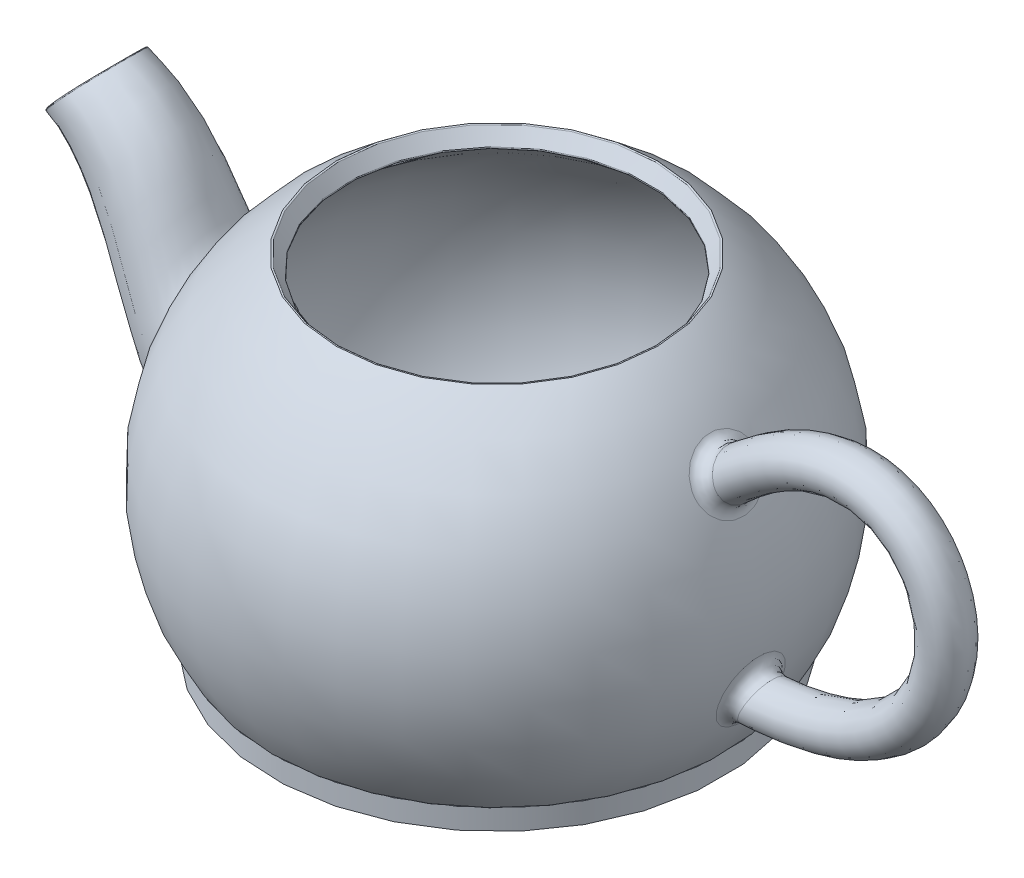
SolidWorks part; units mm, degrees
ref_plane "Спереди" through (0, 0, 0) normal (0, 0, 1) x (1, 0, 0)
ref_plane "Сверху" through (0, 0, 0) normal (0, 1, 0) x (1, 0, 0)
ref_plane "Справа" through (0, 0, 0) normal (1, 0, 0) x (0, 0, -1)
sketch "Эскиз1" plane through (0, 0, 0) normal (0, 0, 1) x (1, 0, 0)
  line L0 (0, 0) -> (350, 0)
  line L1 (0, 0) -> (0, 500)
  line L2 (0, 500) -> (250, 500)
  arc A0 (350, 0) -> (250, 500) centre (50.7704, 200.1541) ccw
  dimension "D3" = 360
  dimension "D1" = 250
  dimension "D2" = 500
  dimension "D4" = 350
revolve "Повернуть1" add sketch "Эскиз1" angle 360 about L1
sketch "Эскиз3" plane through (0, 0, 0) normal (0, 0, 1) x (1, 0, 0)
  line L0 (-694.1726, 404.6063) -> (-617.2746, 468.5336)
  arc A0 (-250, 500) -> (-350, 0) centre (-50.7704, 200.1541) ccw construction
  spline S0 degree 3 poles (-694.1726, 404.6063) (-543.7993, 331.9131) (-550.7728, 35.5272) (-372.0405, 37.7178) knots 0 0 0 0 1 1 1 1
  spline S1 degree 3 poles (-617.2746, 468.5336) (-474.6525, 419.6861) (-493.8046, 256.1572) (-403.7795, 270.7559) knots 0 0 0 0 1 1 1 1
  dimension "D2" = 372.0405
  dimension "D1" = 100
  dimension "D3" = 617.2746
  dimension "D4" = 694.1726
  dimension "D5" = 404.6063
ref_plane "Плоскость3" through (-360.2215, -49.0609, 0) normal (-0.9909, -0.135, 0) x (0, 0, 1)
sketch "Эскиз6" plane through (-360.2215, -49.0609, 0) normal (-0.9909, -0.135, 0) x (0, 0, 1)
  ellipse E0 centre (0, 205.1746) end of major axis (0, 322.7694) minor radius 88.5807
  dimension "D1" = 177.1615
ref_plane "Плоскость5" through (-482.5868, 580.503, 0) normal (-0.6393, 0.769, 0) x (0.769, 0.6393, 0)
sketch "Эскиз8" plane through (-482.5868, 580.503, 0) normal (-0.6393, 0.769, 0) x (0.769, 0.6393, 0)
  ellipse E0 centre (-225.1512, 0) end of major axis (-225.1512, 50) minor radius 50
  dimension "D1" = 100
loft "По сечениям3" add profiles "Эскиз8", "Эскиз6"
surface "Поверхность-Сместить1" parameters "D1"=5
thicken "Придать толщину1" thickness 15 parameters "D1"=15
delete or keep bodies "Тело-Удалить/Сохранить 2" type delete bodies bodies 104
fillet "Скругление5" radius 60 1 edges
fillet "Скругление6" radius 2 4 edges at (0, 491.6709, -244.4658) (0, 516.6581, -261.0683) (0, -11.1197, -366.6239)
sketch "Эскиз12" plane through (0, 0, 0) normal (0, 0, 1) x (1, 0, 0)
  line L0 (128.3836, 99.7524) -> (664.5891, 99.7524) construction
  line L3 (262.74, 515.541) -> (-262.74, 515.541) construction
  line L4 (1507.041, 1516.145) -> (-775.8111, -766.707) construction
  arc A2 (351.0548, 1.586) -> (251.5837, 498.9417) centre (50.7704, 200.1541) ccw
  arc A3 (351.0548, 1.586) -> (251.5837, 498.9417) centre (50.7704, 200.1541) ccw construction
  spline S0 degree 3 poles (365.615, 374.719) (746.0903, 755.1944) (947.5445, 99.7524) (396.4863, 99.7524) knots 0 0 0 0 1 1 1 1
  dimension "D2" = 135
  dimension "D3" = 365.615
  dimension "D4" = 396.4863
  dimension "D1" = 20
ref_plane "Плоскость6" through (365.615, 374.719, 0) normal (0.7071, 0.7071, 0) x (0.7071, -0.7071, 0)
sketch "Эскиз13" plane through (365.615, 374.719, 0) normal (0.7071, 0.7071, 0) x (0.7071, -0.7071, 0)
  ellipse E0 centre (0, 0) end of major axis (0, -37.5) minor radius 35
  dimension "D1" = 75
  dimension "D2" = 70
sweep "По траектории1" add profiles "Эскиз13" path "Эскиз12"
fillet "Скругление7" radius 20 2 edges at (375.1875, 395.09, -36.5181) (416.244, 102.1815, -37.4297)
sketch "Эскиз14" plane through (0, 0, 0) normal (0, 0, 1) x (1, 0, 0)
  line L0 (0, -9.4455) -> (-367.7373, -9.4455)
  line L1 (367.7373, -9.4455) -> (-367.7373, -9.4455) construction
  line L2 (-367.7373, -9.4455) -> (-367.7373, -43.3542)
  line L3 (-367.7373, -43.3542) -> (0, -43.3542)
  line L4 (0, -43.3542) -> (0, -9.4455) construction
  dimension "D1" = 9.4455
  dimension "D2" = 43.3542
surface "Поверхность-Повернуть1" sketch "Эскиз14" parameters "D1"=360
